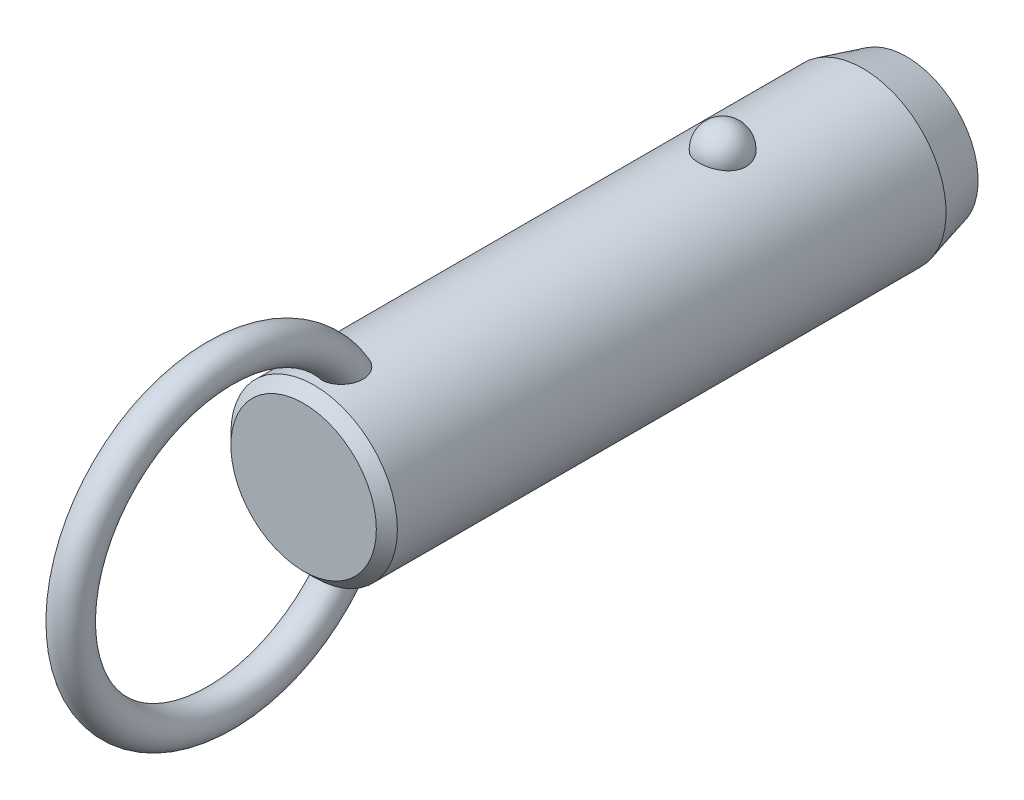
SolidWorks part; units mm, degrees
ref_plane "Front Plane" through (0, 0, 0) normal (0, 0, 1) x (1, 0, 0)
ref_plane "Top Plane" through (0, 0, 0) normal (0, 1, 0) x (1, 0, 0)
ref_plane "Right Plane" through (0, 0, 0) normal (1, 0, 0) x (0, 0, -1)
sketch "Sketch2" plane through (0, 0, 0) normal (0, 0, 1) x (1, 0, 0)
  circle A0 centre (0, 0) radius 9.5
  point P3 (0, 9.5)
  dimension "D1" = 19
extrude "Boss-Extrude1" add sketch "Sketch2" along normal blind 35.6
sketch "Sketch3" plane through (0, 0, 0) normal (0, 0, -1) x (-1, 0, 0)
  circle A0 centre (0, 0) radius 9.5
  dimension "D1" = 19
extrude "Boss-Extrude2" add sketch "Sketch3" along normal blind 23.7
chamfer "Chamfer1" distance 5 angle 15 1 edges at (-9.5, 0, -23.7)
sketch "Sketch12" plane through (0, 0, 0) normal (1, 0, 0) x (0, 0, -1)
  line L0 (-35.6, 9.5) -> (-35.6, -9.5) construction
  point P0 (-35.6, 0)
sketch "Sketch13" plane through (0, 0, 0) normal (1, 0, 0) x (0, 0, -1)
  circle A0 centre (-54.65, 0) radius 19.05
  point P2 (-35.6, 0)
  dimension "D1" = 38.1
sketch "Sketch14" plane through (0, 0, 0) normal (0, 1, 0) x (1, 0, 0)
  circle A0 centre (0, -37.6) radius 2
  point P2 (0, -35.6)
  dimension "D1" = 4
sweep "Sweep1" add profiles "Sketch14" path "Sketch13"
sketch "Sketch15" plane through (0, 0, 35.6) normal (0, 0, 1) x (1, 0, 0)
  circle A0 centre (0, 0) radius 9.5
  dimension "D1" = 19
extrude "Boss-Extrude3" add sketch "Sketch15" along normal blind 9.52
chamfer "Chamfer2" distance 1.2 angle 45 1 edges at (9.5, 0, 45.12)
sketch "Sketch18" plane through (0, 0, 0) normal (1, 0, 0) x (0, 0, -1)
  line L0 (18.7, 9.5) -> (-38.1378, 9.5) construction
  line L1 (2.7, 12.2) -> (2.7, 6.8)
  line L2 (-38.1378, -9.5) -> (18.7, -9.5) construction
  arc A0 (2.7, 12.2) -> (2.7, 6.8) centre (2.7, 9.5) ccw
  point P4 (0, 9.5)
  dimension "D1" = 21.7
revolve "Revolve1" add sketch "Sketch18" angle 360 about L1
